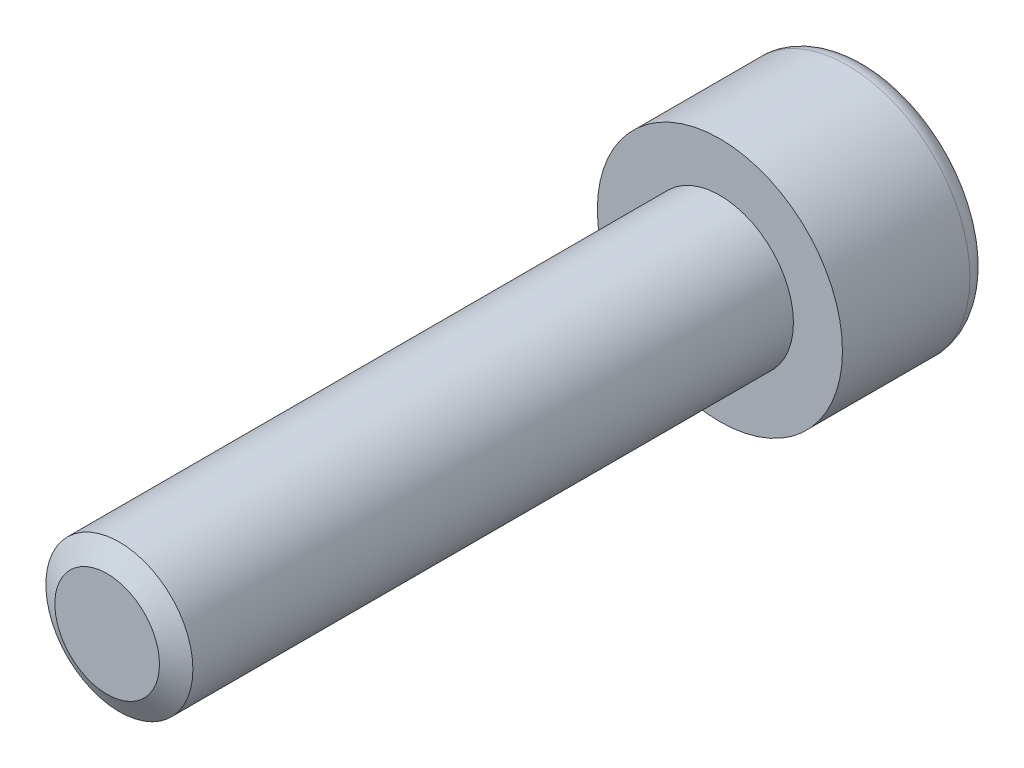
SolidWorks part; units mm, degrees
ref_plane "Plan1" through (0, 0, 0) normal (0, 0, 1) x (1, 0, 0)
ref_plane "Plan2" through (0, 0, 0) normal (0, 1, 0) x (1, 0, 0)
ref_plane "Plan3" through (0, 0, 0) normal (1, 0, 0) x (0, 0, -1)
sketch "Esquisse2" plane through (0, 0, 0) normal (0, 0, 1) x (1, 0, 0)
  circle A0 centre (0, 0) radius 3
  dimension "D1" = 6
extrude "Base-Extrusion" add sketch "Esquisse2" along normal blind 25
chamfer "Chanfrein1" distance 0.5 angle 60
sketch "Esquisse3" plane through (0, 0, 0) normal (0, 0, -1) x (-1, 0, 0)
  circle A0 centre (0, 0) radius 5
  dimension "D1" = 10
extrude "Boss.-Extru.1" add sketch "Esquisse3" along normal blind 6
sketch "Esquisse5" plane through (0, 0, -6) normal (0, 0, -1) x (-1, 0, 0)
  line L0 (-1.4434, 2.5) -> (1.4434, 2.5)
  line L1 (1.4434, 2.5) -> (2.8868, 0)
  line L2 (2.8868, 0) -> (1.4434, -2.5)
  line L3 (1.4434, -2.5) -> (-1.4434, -2.5)
  line L4 (-1.4434, -2.5) -> (-2.8868, 0)
  line L5 (-2.8868, 0) -> (-1.4434, 2.5)
  line L6 (1.4434, 2.5) -> (0, 0) construction
  line L7 (0, 0) -> (-1.4434, 2.5) construction
  line L8 (0, 0) -> (-1.4434, -2.5) construction
  line L9 (0, 0) -> (1.4434, -2.5) construction
  dimension "D1" = 60
  dimension "D2" = 60
  dimension "D3" = 60
  dimension "D4" = 120
  dimension "D5" = 120
  dimension "D6" = 5
extrude "Enlèv. mat.-Extru.1" cut sketch "Esquisse5" against normal blind 4
sketch "Esquisse6" plane through (0, 0, 0) normal (0, 1, 0) x (1, 0, 0)
  line L0 (-2.8868, 2) -> (-2.8868, 6) construction
  line L1 (0, 2) -> (0, 1)
  line L2 (5, 6) -> (-5, 6) construction
  line L3 (0, 6) -> (-2.8868, 6)
  line L4 (-1.4434, 2) -> (1.4434, 2) construction
  line L5 (-2.8868, 2) -> (0, 2)
  line L6 (0, 1) -> (0, 7.3237) construction
  line L7 (0, -24.5) -> (0, 0) construction
  line L8 (-2.8868, 6) -> (0, 5)
  line L9 (0, 5) -> (0, 6)
  line L10 (-2.8868, 2) -> (0, 1)
  line L11 (-2.8868, 2) -> (-2.8868, 6) construction
  dimension "D1" = 1
  dimension "D2" = 1
revolve "Enlèvement de matière-Révolution1" cut sketch "Esquisse6" angle 360 about L6
fillet "Congé1" radius 0.8
